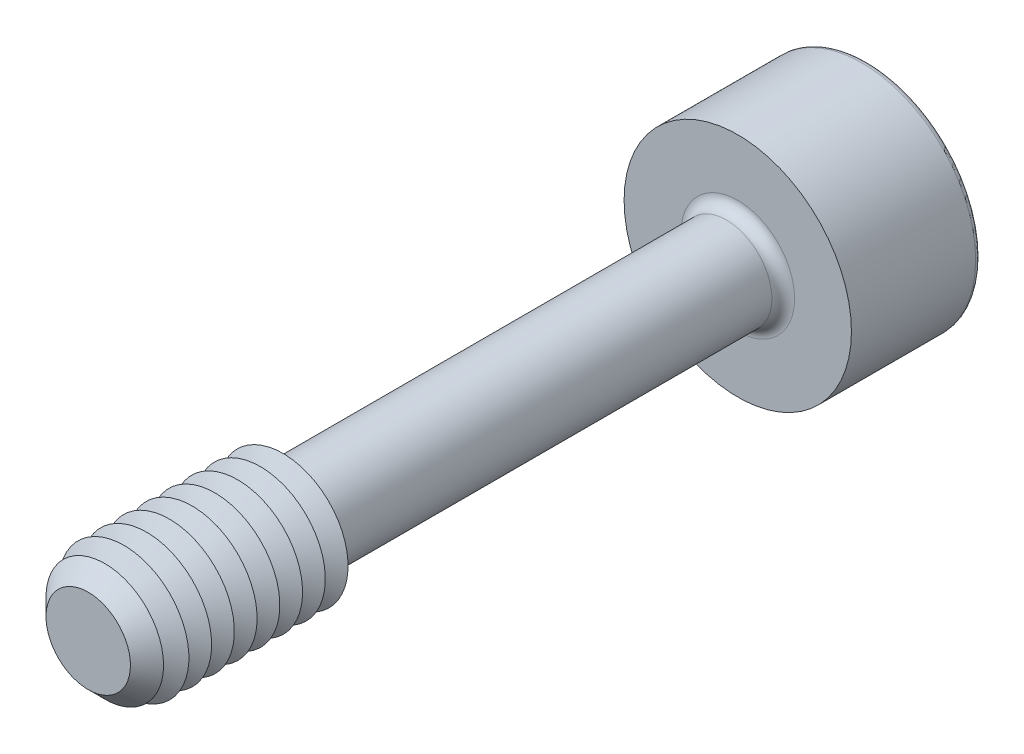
SolidWorks part; units mm, degrees
ref_plane "Front Plane" through (0, 0, 0) normal (0, 0, 1) x (1, 0, 0)
ref_plane "Top Plane" through (0, 0, 0) normal (0, 1, 0) x (1, 0, 0)
ref_plane "Right Plane" through (0, 0, 0) normal (1, 0, 0) x (0, 0, -1)
sketch "Sketch1" plane through (0, 0, 0) normal (0, 0, 1) x (1, 0, 0)
  circle A0 centre (0, 0) radius 1.4
  dimension "D1" = 2.8
extrude "Extrude1" add sketch "Sketch1" along normal mid plane 20
sketch "Sketch2" plane through (0, 0, 0) normal (1, 0, 0) x (0, 0, -1)
  line L0 (-10, 0) -> (-10, 2)
  line L1 (-10, 1.4) -> (-10, -1.4) construction
  line L2 (-10, 2) -> (-4, 2)
  line L3 (-4, 2) -> (-3.6536, 1.4)
  line L4 (10, 1.4) -> (-10, 1.4) construction
  line L5 (-3.6536, 1.4) -> (-3.6536, 0)
  line L6 (-3.6536, 0) -> (-10, 0)
  dimension "D1" = 2
  dimension "D2" = 120
  dimension "D3" = 6
revolve "Revolve1" add sketch "Sketch2" angle 360 about L6
chamfer "Chamfer1" distance 0.7 angle 45 1 edges at (0, 2, 10)
sketch "Sketch3" plane through (0, 0, -10) normal (0, 0, -1) x (-1, 0, 0)
  circle A0 centre (0, 0) radius 3.5
  dimension "D1" = 7
extrude "Extrude2" add sketch "Sketch3" along normal blind 4
sketch "Sketch4" plane through (-13.7, 0, -14) normal (0, 0, 1) x (1, 0, 0)
  line L2 (12.834, -1.5) -> (14.566, -1.5)
  line L3 (14.566, -1.5) -> (15.4321, 0)
  line L4 (15.4321, 0) -> (14.566, 1.5)
  line L6 (14.566, 1.5) -> (12.834, 1.5)
  line L7 (12.834, 1.5) -> (11.9679, 0)
  line L8 (11.9679, 0) -> (12.834, -1.5)
  circle A0 centre (13.7, 0) radius 1.5 construction
  dimension "D1" = 3
extrude "Extrude3" cut sketch "Sketch4" along normal blind 3
fillet "Fillet1" radius 0.35 1 edges at (-1.4, 0, -10)
fillet "Fillet2" radius 0.175 1 edges at (-3.5, 0, -14)
sketch "Sketch5" plane through (0, 0, 0) normal (1, 0, 0) x (0, 0, -1)
  line L0 (11, 0) -> (11, -1.5)
  line L1 (11, -1.5) -> (10.134, 0)
  line L2 (10.134, 0) -> (11, 0)
  dimension "D1" = 30
revolve "Cut-Revolve1" cut sketch "Sketch5" angle 360 about L2
sketch "Sketch6" plane through (0, 0, 0) normal (1, 0, 0) x (0, 0, -1)
  line L0 (1.332, 0) -> (-13.289, 0) construction
sketch "Sketch7" plane through (0, 0, 0) normal (1, 0, 0) x (0, 0, -1)
  line L0 (-4, 2) -> (-4.35, 1.3938)
  line L1 (-4.35, 1.3938) -> (-4.7, 2)
  line L2 (-4, 2) -> (-9.3, 2) construction
  line L3 (-4.7, 2) -> (-4, 2)
  dimension "D1" = 0.7
revolve "Cut-Revolve2" cut sketch "Sketch7" angle 360 about L0
pattern_linear "LPattern1" count 8 spacing 0.7 along (0, 0, 1) of "Cut-Revolve2"
